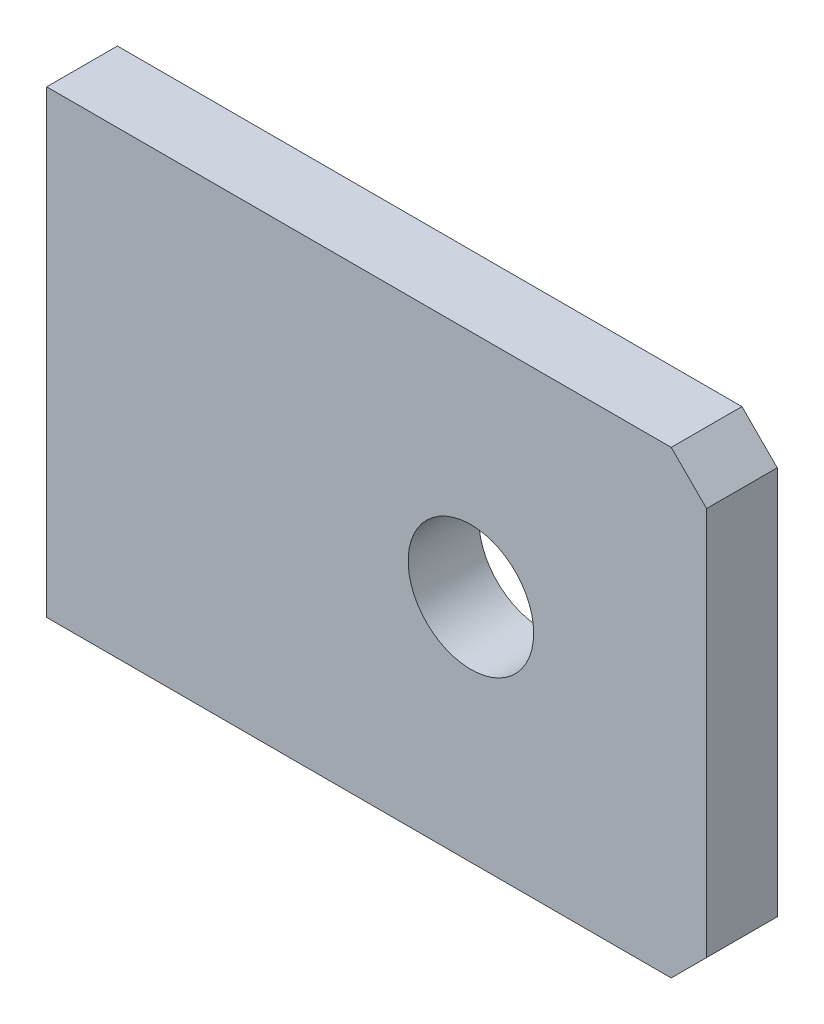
SolidWorks part; units mm, degrees
ref_plane "Front Plane" through (0, 0, 0) normal (0, 0, 1) x (1, 0, 0)
ref_plane "Top Plane" through (0, 0, 0) normal (0, 1, 0) x (1, 0, 0)
ref_plane "Right Plane" through (0, 0, 0) normal (1, 0, 0) x (0, 0, -1)
sketch "Sketch1" plane through (0, 0, 0) normal (0, 0, 1) x (1, 0, 0)
  line L1 (-7.112, -4.953) -> (7.112, -4.953)
  line L2 (-7.112, -4.953) -> (-7.112, 4.953)
  line L3 (-7.112, 4.953) -> (7.112, 4.953)
  line L4 (7.112, -4.953) -> (7.112, 4.953)
  line L5 (-7.112, -4.953) -> (7.112, 4.953) construction
  line L6 (-7.112, 4.953) -> (7.112, -4.953) construction
  point P0 (0, 0)
  dimension "D1" = 14.224
  dimension "D2" = 9.906
sheet metal parameters "Sheet-Metal1" thickness 1.524 parameters "D1"=0.3848
base flange "Base-Flange1" sketch "Sketch1" thickness 1.524 reverse thickness direction no parameters "D1"=0.3848
chamfer "Chamfer2" distance 0.762 angle 45 2 edges at (7.112, -4.953, -0.762) (7.112, 4.953, -0.762)
hole_wizard "#6-32 Tapped Hole1" positions "Sketch14" profile "Sketch13" tap size "#6-32" standard "ANSI Inch"
sketch "Sketch14" plane through (0, 0, 0) normal (0, 0, 1) x (1, 0, 0)
  line L0 (7.112, -4.191) -> (7.112, 4.191) construction
  line L1 (6.35, 4.953) -> (-7.112, 4.953) construction
  point P0 (2.032, 0)
  dimension "D1" = 5.08
  dimension "D2" = 4.953
sketch "Sketch13" plane through (2.032, 0, 0) normal (1, 0, 0) x (0, -1, 0)
  line L0 (0, 0) -> (0, 1.524)
  line L1 (0, 1.524) -> (1.3525, 1.524)
  line L2 (1.3525, 1.524) -> (1.3525, 0)
  line L5 (1.3525, 0) -> (0, 0)
  line L11 (0, -6.35) -> (0, 107.95) construction
  dimension "Thru Tap Drill Dia." = 2.7051
  dimension "Thru Tap Drill Depth" = 1.524
flat pattern "Flat-Pattern1"
sketch "Bend-Lines1" plane through (0, 0, 0) normal (0, 1, 0) x (1, 0, 0)
sketch3d "Bounding-Box1" [suppressed]
  line L0 (7.112, -4.953, 0) -> (-7.112, -4.953, 0) construction
  line L1 (7.112, 4.953, 0) -> (-7.112, 4.953, 0) construction
  line L2 (7.112, -4.953, 0) -> (7.112, 4.953, 0) construction
  line L3 (-7.112, -4.953, 0) -> (-7.112, 4.953, 0) construction
